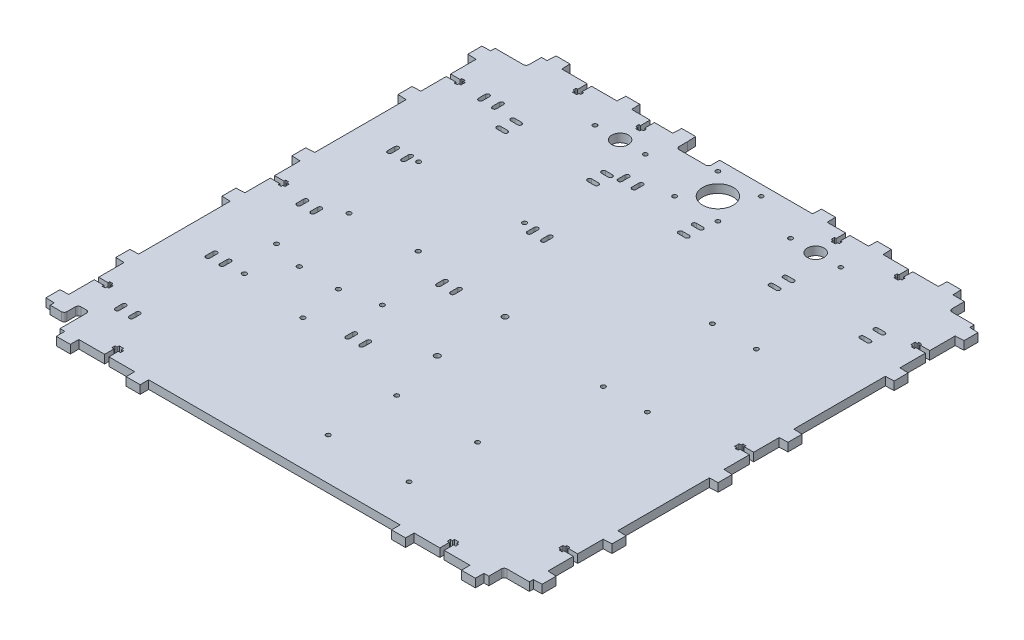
SolidWorks part; units mm, degrees
ref_plane "Спереди" through (0, 0, 0) normal (0, 0, 1) x (1, 0, 0)
ref_plane "Сверху" through (0, 0, 0) normal (0, 1, 0) x (1, 0, 0)
ref_plane "Справа" through (0, 0, 0) normal (1, 0, 0) x (0, 0, -1)
sketch "Эскиз1" plane through (0, 0, 0) normal (0, -1, 0) x (1, 0, 0)
  line L0 (171.5, 17.1) -> (171.5, 20.25)
  line L1 (171.5, 20.25) -> (177.6, 20.5)
  line L2 (177.6, 20.5) -> (177.6, 30.5)
  line L3 (177.6, 30.5) -> (171.5, 30.75)
  line L4 (171.5, 30.75) -> (171.5, 48.95)
  line L5 (171.5, 48.95) -> (164.7, 48.95)
  line L6 (164.7, 48.95) -> (164.7, 47.75)
  line L7 (164.7, 47.75) -> (162.5, 47.75)
  line L8 (162.5, 47.75) -> (162.5, 48.95)
  line L9 (162.5, 48.95) -> (161, 48.95)
  line L10 (161, 48.95) -> (161, 52.05)
  line L11 (161, 52.05) -> (162.5, 52.05)
  line L12 (162.5, 52.05) -> (162.5, 53.25)
  line L13 (162.5, 53.25) -> (164.7, 53.25)
  line L14 (164.7, 53.25) -> (164.7, 52.05)
  line L15 (164.7, 52.05) -> (171.5, 52.05)
  line L16 (171.5, 52.05) -> (171.5, 70.25)
  line L17 (171.5, 70.25) -> (177.6, 70.5)
  line L18 (177.6, 70.5) -> (177.6, 80.5)
  line L19 (177.6, 80.5) -> (171.5, 80.75)
  line L20 (177.6, 146.5) -> (177.6, 156.5)
  line L21 (177.6, 156.5) -> (171.5, 156.75)
  line L22 (171.5, 156.75) -> (171.5, 174.95)
  line L23 (171.5, 174.95) -> (164.7, 174.95)
  line L24 (164.7, 174.95) -> (164.7, 173.75)
  line L25 (164.7, 173.75) -> (162.5, 173.75)
  line L26 (162.5, 173.75) -> (162.5, 174.95)
  line L27 (162.5, 174.95) -> (161, 174.95)
  line L28 (161, 174.95) -> (161, 178.05)
  line L29 (161, 178.05) -> (162.5, 178.05)
  line L30 (162.5, 178.05) -> (162.5, 179.25)
  line L31 (162.5, 179.25) -> (164.7, 179.25)
  line L32 (164.7, 179.25) -> (164.7, 178.05)
  line L33 (164.7, 178.05) -> (171.5, 178.05)
  line L34 (171.5, 178.05) -> (171.5, 196.25)
  line L35 (171.5, 196.25) -> (177.6, 196.5)
  line L36 (177.6, 196.5) -> (177.6, 206.5)
  line L37 (177.6, 206.5) -> (171.5, 206.75)
  line L38 (171.5, 146.25) -> (177.6, 146.5)
  line L39 (177.6, 272.5) -> (177.6, 282.5)
  line L40 (177.6, 282.5) -> (171.5, 282.75)
  line L41 (171.5, 282.75) -> (171.5, 300.95)
  line L42 (171.5, 300.95) -> (164.7, 300.95)
  line L43 (164.7, 300.95) -> (164.7, 299.75)
  line L44 (164.7, 299.75) -> (162.5, 299.75)
  line L45 (162.5, 299.75) -> (162.5, 300.95)
  line L46 (162.5, 300.95) -> (161, 300.95)
  line L47 (161, 300.95) -> (161, 304.05)
  line L48 (161, 304.05) -> (162.5, 304.05)
  line L49 (162.5, 304.05) -> (162.5, 305.25)
  line L50 (162.5, 305.25) -> (164.7, 305.25)
  line L51 (164.7, 305.25) -> (164.7, 304.05)
  line L52 (164.7, 304.05) -> (171.5, 304.05)
  line L53 (171.5, 304.05) -> (171.5, 322.25)
  line L54 (171.5, 322.25) -> (177.6, 322.5)
  line L55 (177.6, 322.5) -> (177.6, 332.5)
  line L56 (177.6, 332.5) -> (171.5, 332.75)
  line L57 (171.5, 272.25) -> (177.6, 272.5)
  line L58 (171.5, 335.6) -> (171.5, 332.75)
  line L59 (171.5, 272.25) -> (171.5, 206.75)
  line L60 (171.5, 146.25) -> (171.5, 80.75)
  line L61 (153.5, 346.6) -> (150, 346.6)
  line L62 (150, 346.6) -> (150, 352.7)
  line L63 (150, 352.7) -> (140, 352.7)
  line L64 (140, 352.7) -> (140, 346.6)
  line L65 (140, 346.6) -> (121.55, 346.6)
  line L66 (121.55, 346.6) -> (121.55, 339.8)
  line L67 (121.55, 339.8) -> (123.05, 339.8)
  line L68 (123.05, 339.8) -> (123.05, 337.6)
  line L69 (123.05, 337.6) -> (121.55, 337.6)
  line L70 (121.55, 337.6) -> (121.55, 336.1)
  line L71 (121.55, 336.1) -> (118.45, 336.1)
  line L72 (118.45, 336.1) -> (118.45, 337.6)
  line L73 (118.45, 337.6) -> (116.95, 337.6)
  line L74 (116.95, 337.6) -> (116.95, 339.8)
  line L75 (116.95, 339.8) -> (118.45, 339.8)
  line L76 (118.45, 339.8) -> (118.45, 346.6)
  line L77 (118.45, 346.6) -> (100, 346.6)
  line L78 (100, 346.6) -> (100, 352.7)
  line L79 (100, 352.7) -> (90, 352.7)
  line L80 (90, 352.7) -> (90, 346.6)
  line L81 (90, 346.6) -> (-90, 346.6)
  line L82 (70, 16.6) -> (70, 0) construction
  line L83 (115, 16.6) -> (115, 0) construction
  line L84 (52, 29.1) -> (88, 29.1) construction
  line L85 (161, 50.5) -> (165.6426, 50.5) construction
  line L86 (-15.5, 13.6) -> (15.5, 13.6) construction
  line L87 (-15.5, 13.6) -> (-15.5, 44.6) construction
  line L88 (-15.5, 44.6) -> (15.5, 44.6) construction
  line L89 (15.5, 13.6) -> (15.5, 44.6) construction
  line L90 (-15.5, 13.6) -> (15.5, 44.6) construction
  line L91 (-15.5, 44.6) -> (15.5, 13.6) construction
  line L92 (-153.5, 335.6) -> (-171.5, 335.6)
  line L93 (-45, 0) -> (-55, 0)
  line L94 (-55, 0) -> (-55.25, 6.1)
  line L95 (-44.75, 6.1) -> (-45, 0)
  line L96 (-85, 0) -> (-95, 0)
  line L97 (-135, 0) -> (-145, 0)
  line L98 (-161, 50.5) -> (-165.6426, 50.5) construction
  line L99 (-52, 29.1) -> (-88, 29.1) construction
  line L100 (-115, 16.6) -> (-115, 0) construction
  line L101 (-70, 16.6) -> (-70, 0) construction
  line L102 (-171.5, 17.1) -> (-149.25, 17.1)
  line L103 (-145, 0) -> (-145.25, 6.1)
  line L104 (-134.75, 6.1) -> (-135, 0)
  line L105 (-116.55, 6.1) -> (-134.75, 6.1)
  line L106 (-116.55, 12.9) -> (-116.55, 6.1)
  line L107 (-117.75, 12.9) -> (-116.55, 12.9)
  line L108 (-117.75, 15.1) -> (-117.75, 12.9)
  line L109 (-116.55, 15.1) -> (-117.75, 15.1)
  line L110 (-116.55, 16.6) -> (-116.55, 15.1)
  line L111 (-113.45, 16.6) -> (-116.55, 16.6)
  line L112 (-113.45, 15.1) -> (-113.45, 16.6)
  line L113 (-112.25, 15.1) -> (-113.45, 15.1)
  line L114 (-112.25, 12.9) -> (-112.25, 15.1)
  line L115 (-113.45, 12.9) -> (-112.25, 12.9)
  line L116 (-113.45, 6.1) -> (-113.45, 12.9)
  line L117 (-95.25, 6.1) -> (-113.45, 6.1)
  line L118 (-95, 0) -> (-95.25, 6.1)
  line L119 (-84.75, 6.1) -> (-85, 0)
  line L120 (-71.55, 6.1) -> (-84.75, 6.1)
  line L121 (-71.55, 12.9) -> (-71.55, 6.1)
  line L122 (-72.75, 12.9) -> (-71.55, 12.9)
  line L123 (-72.75, 15.1) -> (-72.75, 12.9)
  line L124 (-71.55, 15.1) -> (-72.75, 15.1)
  line L125 (-71.55, 16.6) -> (-71.55, 15.1)
  line L126 (-68.45, 16.6) -> (-71.55, 16.6)
  line L127 (-68.45, 15.1) -> (-68.45, 16.6)
  line L128 (-67.25, 15.1) -> (-68.45, 15.1)
  line L129 (-67.25, 12.9) -> (-67.25, 15.1)
  line L130 (-68.45, 12.9) -> (-67.25, 12.9)
  line L131 (-68.45, 6.1) -> (-68.45, 12.9)
  line L132 (-55.25, 6.1) -> (-68.45, 6.1)
  line L133 (-177.6, 80.5) -> (-171.5, 80.75)
  line L134 (-177.6, 70.5) -> (-177.6, 80.5)
  line L135 (-171.5, 70.25) -> (-177.6, 70.5)
  line L136 (-171.5, 52.05) -> (-171.5, 70.25)
  line L137 (-164.7, 52.05) -> (-171.5, 52.05)
  line L138 (-164.7, 53.25) -> (-164.7, 52.05)
  line L139 (-162.5, 53.25) -> (-164.7, 53.25)
  line L140 (-162.5, 52.05) -> (-162.5, 53.25)
  line L141 (-161, 52.05) -> (-162.5, 52.05)
  line L142 (-161, 48.95) -> (-161, 52.05)
  line L143 (-162.5, 48.95) -> (-161, 48.95)
  line L144 (-162.5, 47.75) -> (-162.5, 48.95)
  line L145 (-164.7, 47.75) -> (-162.5, 47.75)
  line L146 (-164.7, 48.95) -> (-164.7, 47.75)
  line L147 (-171.5, 48.95) -> (-164.7, 48.95)
  line L148 (-171.5, 30.75) -> (-171.5, 48.95)
  line L149 (-177.6, 30.5) -> (-171.5, 30.75)
  line L150 (-177.6, 20.5) -> (-177.6, 30.5)
  line L151 (-171.5, 20.25) -> (-177.6, 20.5)
  line L152 (-171.5, 17.1) -> (-171.5, 20.25)
  line L153 (-153.5, 346.6) -> (-153.5, 335.6)
  line L154 (-90, 352.7) -> (-90, 346.6)
  line L155 (-100, 352.7) -> (-90, 352.7)
  line L156 (-100, 346.6) -> (-100, 352.7)
  line L157 (-118.45, 346.6) -> (-100, 346.6)
  line L158 (-118.45, 339.8) -> (-118.45, 346.6)
  line L159 (-116.95, 339.8) -> (-118.45, 339.8)
  line L160 (-116.95, 337.6) -> (-116.95, 339.8)
  line L161 (-118.45, 337.6) -> (-116.95, 337.6)
  line L162 (-118.45, 336.1) -> (-118.45, 337.6)
  line L163 (-121.55, 336.1) -> (-118.45, 336.1)
  line L164 (-121.55, 337.6) -> (-121.55, 336.1)
  line L165 (-123.05, 337.6) -> (-121.55, 337.6)
  line L166 (-123.05, 339.8) -> (-123.05, 337.6)
  line L167 (-121.55, 339.8) -> (-123.05, 339.8)
  line L168 (-121.55, 346.6) -> (-121.55, 339.8)
  line L169 (-140, 346.6) -> (-121.55, 346.6)
  line L170 (-140, 352.7) -> (-140, 346.6)
  line L171 (-150, 352.7) -> (-140, 352.7)
  line L172 (-150, 346.6) -> (-150, 352.7)
  line L173 (-153.5, 346.6) -> (-150, 346.6)
  line L174 (-171.5, 146.25) -> (-171.5, 80.75)
  line L175 (-171.5, 272.25) -> (-171.5, 206.75)
  line L176 (-171.5, 335.6) -> (-171.5, 332.75)
  line L177 (-171.5, 272.25) -> (-177.6, 272.5)
  line L178 (-177.6, 332.5) -> (-171.5, 332.75)
  line L179 (-177.6, 322.5) -> (-177.6, 332.5)
  line L180 (-171.5, 322.25) -> (-177.6, 322.5)
  line L181 (-171.5, 304.05) -> (-171.5, 322.25)
  line L182 (-164.7, 304.05) -> (-171.5, 304.05)
  line L183 (-164.7, 305.25) -> (-164.7, 304.05)
  line L184 (-162.5, 305.25) -> (-164.7, 305.25)
  line L185 (-162.5, 304.05) -> (-162.5, 305.25)
  line L186 (-161, 304.05) -> (-162.5, 304.05)
  line L187 (-161, 300.95) -> (-161, 304.05)
  line L188 (-162.5, 300.95) -> (-161, 300.95)
  line L189 (-162.5, 299.75) -> (-162.5, 300.95)
  line L190 (-164.7, 299.75) -> (-162.5, 299.75)
  line L191 (-164.7, 300.95) -> (-164.7, 299.75)
  line L192 (-171.5, 300.95) -> (-164.7, 300.95)
  line L193 (-171.5, 282.75) -> (-171.5, 300.95)
  line L194 (-177.6, 282.5) -> (-171.5, 282.75)
  line L195 (-177.6, 272.5) -> (-177.6, 282.5)
  line L196 (-171.5, 146.25) -> (-177.6, 146.5)
  line L197 (-177.6, 206.5) -> (-171.5, 206.75)
  line L198 (-177.6, 196.5) -> (-177.6, 206.5)
  line L199 (-171.5, 196.25) -> (-177.6, 196.5)
  line L200 (-171.5, 178.05) -> (-171.5, 196.25)
  line L201 (-164.7, 178.05) -> (-171.5, 178.05)
  line L202 (-164.7, 179.25) -> (-164.7, 178.05)
  line L203 (-44.75, 6.1) -> (44.75, 6.1)
  line L204 (44.75, 6.1) -> (45, 0)
  line L205 (45, 0) -> (55, 0)
  line L206 (55, 0) -> (55.25, 6.1)
  line L207 (55.25, 6.1) -> (68.45, 6.1)
  line L208 (68.45, 6.1) -> (68.45, 12.9)
  line L209 (68.45, 12.9) -> (67.25, 12.9)
  line L210 (67.25, 12.9) -> (67.25, 15.1)
  line L211 (67.25, 15.1) -> (68.45, 15.1)
  line L212 (68.45, 15.1) -> (68.45, 16.6)
  line L213 (68.45, 16.6) -> (71.55, 16.6)
  line L214 (71.55, 16.6) -> (71.55, 15.1)
  line L215 (71.55, 15.1) -> (72.75, 15.1)
  line L216 (72.75, 15.1) -> (72.75, 12.9)
  line L217 (72.75, 12.9) -> (71.55, 12.9)
  line L218 (71.55, 12.9) -> (71.55, 6.1)
  line L219 (71.55, 6.1) -> (84.75, 6.1)
  line L220 (84.75, 6.1) -> (85, 0)
  line L221 (85, 0) -> (95, 0)
  line L222 (95, 0) -> (95.25, 6.1)
  line L223 (95.25, 6.1) -> (113.45, 6.1)
  line L224 (113.45, 6.1) -> (113.45, 12.9)
  line L225 (113.45, 12.9) -> (112.25, 12.9)
  line L226 (112.25, 12.9) -> (112.25, 15.1)
  line L227 (112.25, 15.1) -> (113.45, 15.1)
  line L228 (113.45, 15.1) -> (113.45, 16.6)
  line L229 (113.45, 16.6) -> (116.55, 16.6)
  line L230 (116.55, 16.6) -> (116.55, 15.1)
  line L231 (116.55, 15.1) -> (117.75, 15.1)
  line L232 (117.75, 15.1) -> (117.75, 12.9)
  line L233 (117.75, 12.9) -> (116.55, 12.9)
  line L234 (116.55, 12.9) -> (116.55, 6.1)
  line L235 (116.55, 6.1) -> (134.75, 6.1)
  line L236 (134.75, 6.1) -> (135, 0)
  line L237 (135, 0) -> (145, 0)
  line L238 (145, 0) -> (145.25, 6.1)
  line L239 (145.25, 6.1) -> (153.5, 6.1)
  line L240 (0, 346.6) -> (0, 0) construction
  line L241 (0, 0) -> (321.4355, 0) construction
  line L242 (-162.5, 179.25) -> (-164.7, 179.25)
  line L243 (-162.5, 178.05) -> (-162.5, 179.25)
  line L244 (-161, 178.05) -> (-162.5, 178.05)
  line L245 (-161, 174.95) -> (-161, 178.05)
  line L246 (-162.5, 174.95) -> (-161, 174.95)
  line L247 (-162.5, 173.75) -> (-162.5, 174.95)
  line L248 (-164.7, 173.75) -> (-162.5, 173.75)
  line L249 (-164.7, 174.95) -> (-164.7, 173.75)
  line L250 (-171.5, 174.95) -> (-164.7, 174.95)
  line L251 (-171.5, 156.75) -> (-171.5, 174.95)
  line L252 (-177.6, 156.5) -> (-171.5, 156.75)
  line L253 (-177.6, 146.5) -> (-177.6, 156.5)
  line L254 (171.5, 17.1) -> (153.5, 17.1)
  line L255 (153.5, 17.1) -> (153.5, 6.1)
  line L256 (-149.25, 17.1) -> (-149.25, 6.1)
  line L257 (-149.25, 6.1) -> (-145.25, 6.1)
  line L258 (153.5, 346.6) -> (153.5, 335.6)
  line L259 (153.5, 335.6) -> (171.5, 335.6)
  line L260 (120, 336.1) -> (120, 359.0244) construction
  line L261 (161, 176.5) -> (-15.5, 176.5) construction
  circle A2 centre (-15.5, 44.6) radius 1.5
  circle A3 centre (-15.5, 13.6) radius 1.5
  circle A4 centre (-70, 29.1) radius 5.95
  circle A5 centre (-52, 29.1) radius 1.5
  circle A6 centre (-88, 29.1) radius 1.5
  circle A9 centre (0, 29.1) radius 11
  circle A10 centre (88, 29.1) radius 1.5
  circle A11 centre (52, 29.1) radius 1.5
  circle A12 centre (70, 29.1) radius 5.95
  circle A14 centre (15.5, 13.6) radius 1.5
  circle A15 centre (15.5, 44.6) radius 1.5
  point P23 (177.6, 25.5)
  point P24 (177.6, 75.5)
  point P45 (177.6, 327.5)
  point P64 (177.6, 201.5)
  point P93 (50, 0)
  point P94 (90, 0)
  point P95 (140, 0)
  point P103 (161, 176.5)
  point P110 (0, 6.1)
  point P181 (177.6, 201.5)
  dimension "D3" = 11.9
  dimension "D4" = 22
  dimension "D5" = 31
  dimension "D8" = 23
  dimension "D10" = 140
  dimension "D11" = 3
  dimension "D24" = 18
  dimension "D1" = 343
  dimension "D2" = 340.5
  dimension "D6" = 6.1
  dimension "D7" = 6.1
  dimension "D9" = 36
  dimension "D12" = 40
  dimension "D13" = 50
  dimension "D14" = 70
  dimension "D15" = 10
  dimension "D16" = 10.5
  dimension "D17" = 3.1
  dimension "D18" = 10.5
  dimension "D19" = 45
  dimension "D20" = 2.2
  dimension "D21" = 5.5
  dimension "D22" = 1.5
  dimension "D23" = 100
  dimension "D25" = 6.1
  dimension "D26" = 50
  dimension "D27" = 50
  dimension "D28" = 101
  dimension "D30" = 176.5
  dimension "D31" = 10
  dimension "D32" = 11
  dimension "D33" = 90
  dimension "D34" = 30
  dimension "D35" = 4
  dimension "D29" = 3
extrude "Бобышка-Вытянуть1" add sketch "Эскиз1" against normal blind 6
fillet "Скругление1" radius 2 4 edges at (153.5, 3, 17.1) (153.5, 3, 335.6) (-153.5, 3, 335.6) (-149.25, 3, 17.1)
sketch "Эскиз2" plane through (0, 0, 0) normal (0, -1, 0) x (1, 0, 0)
  line L0 (-106.26, 222.47) -> (-78.32, 222.47) construction
  line L1 (-73.24, 170.4) -> (-73.24, 252.95) construction
  line L2 (-121.5, 246.6) -> (-73.24, 246.6) construction
  line L3 (-121.5, 171.67) -> (-121.5, 246.6) construction
  line L4 (-171.5, 272.25) -> (-171.5, 206.75) construction
  line L5 (90, 346.6) -> (-90, 346.6) construction
  circle A0 centre (-73.24, 252.95) radius 1.6
  circle A1 centre (-121.5, 171.67) radius 1.6
  circle A2 centre (-121.5, 246.6) radius 1.6
  circle A3 centre (-73.24, 170.4) radius 1.6
  circle A4 centre (-106.26, 222.47) radius 1.6
  circle A5 centre (-78.32, 222.47) radius 1.6
  dimension "D10" = 3.2
  dimension "D2" = 6.35
  dimension "D5" = 5.08
  dimension "D3" = 48.26
  dimension "D4" = 82.55
  dimension "D6" = 74.93
  dimension "D7" = 24.13
  dimension "D8" = 27.94
  dimension "D9" = 50
  dimension "D11" = 100
sketch "Эскиз4" plane through (0, 6, 0) normal (0, -1, 0) x (1, 0, 0)
  line L0 (-44.75, 6.1) -> (44.75, 6.1) construction
  line L1 (-44.75, 6.1) -> (-21.75, 6.1)
  line L2 (-44.75, 6.1) -> (-44.75, 14.1)
  line L3 (-44.75, 14.1) -> (-21.75, 14.1)
  line L4 (-21.75, 6.1) -> (-21.75, 14.1)
  dimension "D1" = 23
  dimension "D2" = 8
extrude "Вырез-Вытянуть2" cut sketch "Эскиз4" along normal through all
fillet "Скругление2" radius 2 2 edges at (-44.75, 3, 14.1) (-21.75, 3, 14.1)
extrude "Вырез-Вытянуть3" cut sketch "Эскиз2" against normal through all
sketch "Эскиз3" plane through (0, 0, 0) normal (0, -1, 0) x (1, 0, 0)
  line L0 (-1.5, 228.5) -> (-1.5, 180) construction
  line L1 (-171.5, 272.25) -> (-171.5, 206.75) construction
  circle A0 centre (-1.5, 228.5) radius 2.05
  circle A1 centre (-1.5, 180) radius 2.05
  dimension "D1" = 48.5
  dimension "D2" = 4.1
  dimension "D3" = 170
  dimension "D4" = 180
extrude "Вырез-Вытянуть1" cut sketch "Эскиз3" against normal through all
sketch "Эскиз8" plane through (0, 0, 0) normal (0, -1, 0) x (1, 0, 0)
  line L0 (0, 0) -> (0, 358.0483) construction
  line L1 (0, 0) -> (-168.3703, 0) construction
  line L2 (-140, 267.0244) -> (-140, 0) construction
  line L3 (-145, 0) -> (-135, 0) construction
  line L4 (-40, 254.7845) -> (-40, 0) construction
  line L5 (-145, 249.1) -> (-145, 244.1) construction
  line L6 (-143.5, 249.1) -> (-143.5, 244.1)
  line L7 (-146.5, 249.1) -> (-146.5, 244.1)
  line L8 (-45, 249.1) -> (-45, 244.1) construction
  line L9 (-43.5, 249.1) -> (-43.5, 244.1)
  line L10 (-46.5, 249.1) -> (-46.5, 244.1)
  line L11 (-45, 184.1) -> (-45, 179.1) construction
  line L12 (-43.5, 184.1) -> (-43.5, 179.1)
  line L13 (-46.5, 184.1) -> (-46.5, 179.1)
  line L14 (-45, 119.1) -> (-45, 114.1) construction
  line L15 (-43.5, 119.1) -> (-43.5, 114.1)
  line L16 (-46.5, 119.1) -> (-46.5, 114.1)
  line L17 (-45, 54.1) -> (-45, 49.1) construction
  line L18 (-43.5, 54.1) -> (-43.5, 49.1)
  line L19 (-46.5, 54.1) -> (-46.5, 49.1)
  line L20 (-145, 314.1) -> (-145, 309.1) construction
  line L21 (-143.5, 314.1) -> (-143.5, 309.1)
  line L22 (-146.5, 314.1) -> (-146.5, 309.1)
  line L23 (-145, 184.1) -> (-145, 179.1) construction
  line L24 (-143.5, 184.1) -> (-143.5, 179.1)
  line L25 (-146.5, 184.1) -> (-146.5, 179.1)
  line L26 (-145, 119.1) -> (-145, 114.1) construction
  line L27 (-143.5, 119.1) -> (-143.5, 114.1)
  line L28 (-146.5, 119.1) -> (-146.5, 114.1)
  line L29 (-145, 54.1) -> (-145, 49.1) construction
  line L30 (-143.5, 54.1) -> (-143.5, 49.1)
  line L31 (-146.5, 54.1) -> (-146.5, 49.1)
  line L32 (-135, 314.1) -> (-135, 309.1) construction
  line L33 (-136.5, 314.1) -> (-136.5, 309.1)
  line L34 (-133.5, 314.1) -> (-133.5, 309.1)
  line L35 (-121.55, 346.6) -> (-140, 346.6) construction
  line L39 (-135, 54.1) -> (-135, 49.1) construction
  line L40 (-136.5, 54.1) -> (-136.5, 49.1)
  line L41 (-133.5, 54.1) -> (-133.5, 49.1)
  line L42 (-135, 119.1) -> (-135, 114.1) construction
  line L43 (-136.5, 119.1) -> (-136.5, 114.1)
  line L44 (-133.5, 119.1) -> (-133.5, 114.1)
  line L45 (-135, 184.1) -> (-135, 179.1) construction
  line L46 (-136.5, 184.1) -> (-136.5, 179.1)
  line L47 (-133.5, 184.1) -> (-133.5, 179.1)
  line L48 (-135, 249.1) -> (-135, 244.1) construction
  line L49 (-136.5, 249.1) -> (-136.5, 244.1)
  line L50 (-133.5, 249.1) -> (-133.5, 244.1)
  line L81 (-45, 249.1) -> (-45, 184.1) construction
  line L82 (-35, 249.1) -> (-35, 184.1) construction
  line L86 (-35, 54.1) -> (-35, 49.1) construction
  line L87 (-36.5, 54.1) -> (-36.5, 49.1)
  line L88 (-33.5, 54.1) -> (-33.5, 49.1)
  line L89 (-35, 119.1) -> (-35, 114.1) construction
  line L90 (-36.5, 119.1) -> (-36.5, 114.1)
  line L91 (-33.5, 119.1) -> (-33.5, 114.1)
  line L92 (-35, 184.1) -> (-35, 179.1) construction
  line L93 (-36.5, 184.1) -> (-36.5, 179.1)
  line L94 (-33.5, 184.1) -> (-33.5, 179.1)
  line L95 (-35, 249.1) -> (-35, 244.1) construction
  line L96 (-36.5, 249.1) -> (-36.5, 244.1)
  line L97 (-33.5, 249.1) -> (-33.5, 244.1)
  line L458 (-135, 184.1) -> (-135, 179.1) construction
  line L459 (-133.5, 184.1) -> (-133.5, 179.1)
  line L460 (-136.5, 184.1) -> (-136.5, 179.1)
  line L461 (-135, 119.1) -> (-135, 114.1) construction
  line L462 (-133.5, 119.1) -> (-133.5, 114.1)
  line L463 (-136.5, 119.1) -> (-136.5, 114.1)
  line L464 (-135, 54.1) -> (-135, 49.1) construction
  line L465 (-133.5, 54.1) -> (-133.5, 49.1)
  line L466 (-136.5, 54.1) -> (-136.5, 49.1)
  line L467 (-135, 249.1) -> (-135, 244.1) construction
  line L468 (-133.5, 249.1) -> (-133.5, 244.1)
  line L469 (-136.5, 249.1) -> (-136.5, 244.1)
  line L470 (-135, 184.1) -> (-135, 179.1) construction
  line L471 (-133.5, 184.1) -> (-133.5, 179.1)
  line L472 (-136.5, 184.1) -> (-136.5, 179.1)
  line L473 (-135, 119.1) -> (-135, 114.1) construction
  line L474 (-133.5, 119.1) -> (-133.5, 114.1)
  line L475 (-136.5, 119.1) -> (-136.5, 114.1)
  line L476 (-135, 54.1) -> (-135, 49.1) construction
  line L477 (-133.5, 54.1) -> (-133.5, 49.1)
  line L478 (-136.5, 54.1) -> (-136.5, 49.1)
  line L479 (-135, 249.1) -> (-135, 244.1) construction
  line L480 (-133.5, 249.1) -> (-133.5, 244.1)
  line L481 (-136.5, 249.1) -> (-136.5, 244.1)
  arc A0 (-143.5, 249.1) -> (-146.5, 249.1) centre (-145, 249.1) ccw
  arc A1 (-146.5, 244.1) -> (-143.5, 244.1) centre (-145, 244.1) ccw
  arc A2 (-43.5, 249.1) -> (-46.5, 249.1) centre (-45, 249.1) ccw
  arc A3 (-46.5, 244.1) -> (-43.5, 244.1) centre (-45, 244.1) ccw
  arc A4 (-43.5, 184.1) -> (-46.5, 184.1) centre (-45, 184.1) ccw
  arc A5 (-46.5, 179.1) -> (-43.5, 179.1) centre (-45, 179.1) ccw
  arc A6 (-43.5, 119.1) -> (-46.5, 119.1) centre (-45, 119.1) ccw
  arc A7 (-46.5, 114.1) -> (-43.5, 114.1) centre (-45, 114.1) ccw
  arc A8 (-43.5, 54.1) -> (-46.5, 54.1) centre (-45, 54.1) ccw
  arc A9 (-46.5, 49.1) -> (-43.5, 49.1) centre (-45, 49.1) ccw
  arc A10 (-143.5, 314.1) -> (-146.5, 314.1) centre (-145, 314.1) ccw
  arc A11 (-146.5, 309.1) -> (-143.5, 309.1) centre (-145, 309.1) ccw
  arc A12 (-143.5, 184.1) -> (-146.5, 184.1) centre (-145, 184.1) ccw
  arc A13 (-146.5, 179.1) -> (-143.5, 179.1) centre (-145, 179.1) ccw
  arc A14 (-143.5, 119.1) -> (-146.5, 119.1) centre (-145, 119.1) ccw
  arc A15 (-146.5, 114.1) -> (-143.5, 114.1) centre (-145, 114.1) ccw
  arc A16 (-143.5, 54.1) -> (-146.5, 54.1) centre (-145, 54.1) ccw
  arc A17 (-146.5, 49.1) -> (-143.5, 49.1) centre (-145, 49.1) ccw
  arc A18 (-136.5, 314.1) -> (-133.5, 314.1) centre (-135, 314.1) cw
  arc A19 (-133.5, 309.1) -> (-136.5, 309.1) centre (-135, 309.1) cw
  arc A22 (-136.5, 54.1) -> (-133.5, 54.1) centre (-135, 54.1) cw
  arc A23 (-133.5, 49.1) -> (-136.5, 49.1) centre (-135, 49.1) cw
  arc A24 (-136.5, 119.1) -> (-133.5, 119.1) centre (-135, 119.1) cw
  arc A25 (-133.5, 114.1) -> (-136.5, 114.1) centre (-135, 114.1) cw
  arc A26 (-136.5, 184.1) -> (-133.5, 184.1) centre (-135, 184.1) cw
  arc A27 (-133.5, 179.1) -> (-136.5, 179.1) centre (-135, 179.1) cw
  arc A28 (-136.5, 249.1) -> (-133.5, 249.1) centre (-135, 249.1) cw
  arc A29 (-133.5, 244.1) -> (-136.5, 244.1) centre (-135, 244.1) cw
  arc A32 (-36.5, 54.1) -> (-33.5, 54.1) centre (-35, 54.1) cw
  arc A33 (-33.5, 49.1) -> (-36.5, 49.1) centre (-35, 49.1) cw
  arc A34 (-36.5, 119.1) -> (-33.5, 119.1) centre (-35, 119.1) cw
  arc A35 (-33.5, 114.1) -> (-36.5, 114.1) centre (-35, 114.1) cw
  arc A36 (-36.5, 184.1) -> (-33.5, 184.1) centre (-35, 184.1) cw
  arc A37 (-33.5, 179.1) -> (-36.5, 179.1) centre (-35, 179.1) cw
  arc A38 (-36.5, 249.1) -> (-33.5, 249.1) centre (-35, 249.1) cw
  arc A39 (-33.5, 244.1) -> (-36.5, 244.1) centre (-35, 244.1) cw
  arc A298 (-133.5, 184.1) -> (-136.5, 184.1) centre (-135, 184.1) ccw
  arc A299 (-136.5, 179.1) -> (-133.5, 179.1) centre (-135, 179.1) ccw
  arc A300 (-133.5, 119.1) -> (-136.5, 119.1) centre (-135, 119.1) ccw
  arc A301 (-136.5, 114.1) -> (-133.5, 114.1) centre (-135, 114.1) ccw
  arc A302 (-133.5, 54.1) -> (-136.5, 54.1) centre (-135, 54.1) ccw
  arc A303 (-136.5, 49.1) -> (-133.5, 49.1) centre (-135, 49.1) ccw
  arc A304 (-133.5, 249.1) -> (-136.5, 249.1) centre (-135, 249.1) ccw
  arc A305 (-136.5, 244.1) -> (-133.5, 244.1) centre (-135, 244.1) ccw
  point P12 (-145, 246.6)
  point P21 (-45, 246.6)
  point P22 (-136, 193.6)
  point P29 (-136, 143.6)
  point P31 (-45, 181.6)
  point P36 (-136, 93.6)
  point P39 (-45, 116.6)
  point P43 (-136, 43.6)
  point P47 (-45, 51.6)
  point P51 (-145, 311.6)
  point P57 (-145, 181.6)
  point P64 (-145, 116.6)
  point P71 (-145, 51.6)
  point P79 (-135, 311.6)
  point P85 (-136, 243.6)
  point P93 (-135, 51.6)
  point P100 (-135, 116.6)
  point P107 (-135, 181.6)
  point P114 (-135, 246.6)
  point P121 (-136, 193.6)
  point P128 (-136, 143.6)
  point P135 (-136, 93.6)
  point P142 (-136, 43.6)
  point P149 (-136, 243.6)
  point P156 (-135, 193.6)
  point P163 (-135, 143.6)
  point P170 (-135, 93.6)
  point P177 (-135, 43.6)
  point P184 (-135, 243.6)
  point P205 (-35, 51.6)
  point P212 (-35, 116.6)
  point P218 (-35, 181.6)
  point P224 (-35, 246.6)
  point P231 (-135, 193.6)
  point P238 (-135, 143.6)
  point P245 (-135, 93.6)
  point P252 (-135, 43.6)
  point P259 (-135, 243.6)
  point P266 (-135, 193.6)
  point P273 (-135, 143.6)
  point P280 (-135, 93.6)
  point P287 (-135, 43.6)
  point P294 (-135, 243.6)
  point P301 (-135, 193.6)
  point P308 (-135, 143.6)
  point P315 (-135, 93.6)
  point P322 (-135, 43.6)
  point P329 (-135, 243.6)
  point P336 (-135, 193.6)
  point P343 (-135, 143.6)
  point P350 (-135, 93.6)
  point P357 (-135, 43.6)
  point P364 (-135, 243.6)
  point P371 (-135, 193.6)
  point P378 (-135, 143.6)
  point P385 (-135, 93.6)
  point P392 (-135, 43.6)
  point P399 (-135, 243.6)
  point P406 (-135, 193.6)
  point P413 (-135, 143.6)
  point P420 (-135, 93.6)
  point P427 (-135, 43.6)
  point P434 (-135, 243.6)
  point P441 (-135, 193.6)
  point P448 (-135, 143.6)
  point P455 (-135, 93.6)
  point P462 (-135, 43.6)
  point P469 (-135, 243.6)
  point P476 (-135, 178.6)
  point P483 (-135, 113.6)
  point P490 (-135, 48.6)
  point P504 (-135, 243.6)
  point P511 (-135, 178.6)
  point P518 (-135, 113.6)
  point P525 (-135, 48.6)
  point P532 (-135, 243.6)
  point P539 (-135, 178.6)
  point P546 (-135, 113.6)
  point P553 (-135, 48.6)
  point P560 (-135, 243.6)
  point P567 (-135, 178.6)
  point P574 (-135, 113.6)
  point P581 (-135, 48.6)
  point P588 (-135, 243.6)
  point P595 (-135, 178.6)
  point P602 (-135, 113.6)
  point P609 (-135, 48.6)
  point P616 (-135, 243.6)
  point P623 (-135, 178.6)
  point P630 (-135, 113.6)
  point P637 (-135, 48.6)
  point P644 (-135, 243.6)
  point P651 (-135, 178.6)
  point P658 (-135, 113.6)
  point P665 (-135, 48.6)
  point P672 (-135, 243.6)
  point P679 (-135, 178.6)
  point P686 (-135, 113.6)
  point P693 (-135, 48.6)
  point P700 (-135, 243.6)
  point P707 (-135, 178.6)
  point P714 (-135, 113.6)
  point P721 (-135, 48.6)
  point P728 (-135, 243.6)
  point P735 (-135, 178.6)
  point P742 (-135, 113.6)
  point P749 (-135, 48.6)
  point P756 (-135, 243.6)
  point P763 (-135, 178.6)
  point P770 (-135, 113.6)
  point P777 (-135, 48.6)
  point P784 (-135, 243.6)
  point P791 (-135, 178.6)
  point P798 (-135, 113.6)
  point P805 (-135, 48.6)
  point P812 (-135, 243.6)
  point P819 (-135, 181.6)
  point P826 (-135, 116.6)
  point P833 (-135, 51.6)
  point P840 (-135, 246.6)
  point P847 (-135, 181.6)
  point P854 (-135, 116.6)
  point P861 (-135, 51.6)
  point P868 (-135, 246.6)
  point P875 (-135, 181.6)
  point P882 (-135, 116.6)
  point P889 (-135, 51.6)
  point P896 (-135, 246.6)
  point P903 (-135, 181.6)
  point P910 (-135, 116.6)
  point P917 (-135, 51.6)
  point P924 (-135, 246.6)
  point P931 (-135, 181.6)
  point P938 (-135, 116.6)
  point P945 (-135, 51.6)
  point P952 (-135, 246.6)
  point P959 (-135, 181.6)
  point P966 (-135, 116.6)
  point P973 (-135, 51.6)
  point P980 (-135, 246.6)
  point P987 (-135, 181.6)
  point P994 (-135, 116.6)
  point P1001 (-135, 51.6)
  point P1008 (-135, 246.6)
  point P1015 (-135, 181.6)
  point P1022 (-135, 116.6)
  point P1029 (-135, 51.6)
  point P1036 (-135, 246.6)
  point P1043 (-135, 181.6)
  point P1050 (-135, 116.6)
  point P1057 (-135, 51.6)
  point P1064 (-135, 246.6)
  point P1071 (-135, 181.6)
  point P1078 (-135, 116.6)
  point P1085 (-135, 51.6)
  point P1092 (-135, 246.6)
  point P1099 (-135, 181.6)
  point P1106 (-135, 116.6)
  point P1113 (-135, 51.6)
  point P1120 (-135, 246.6)
  dimension "D2" = 1.5
  dimension "D1" = 40
  dimension "D5" = 100
  dimension "D6" = 5
  dimension "D7" = 10
  dimension "D8" = 65
  dimension "D9" = 10
  dimension "D11" = 65
  dimension "D12" = 65
  dimension "D13" = 10
  dimension "D3" = 2
  dimension "D4" = 4
  dimension "D10" = 4
extrude "Вырез-Вытянуть4" cut sketch "Эскиз8" against normal through all and the other way through all
sketch "Эскиз9" plane through (0, 0, 0) normal (0, -1, 0) x (1, 0, 0)
  line L0 (-171.5, 60) -> (171.5, 60) construction
  line L1 (-171.5, 70.25) -> (-171.5, 52.05) construction
  line L2 (171.5, 52.05) -> (171.5, 70.25) construction
  line L3 (144, 65) -> (139, 65) construction
  line L4 (144, 63.5) -> (139, 63.5)
  line L5 (144, 66.5) -> (139, 66.5)
  line L6 (79, 65) -> (74, 65) construction
  line L7 (79, 63.5) -> (74, 63.5)
  line L8 (79, 66.5) -> (74, 66.5)
  line L9 (14, 65) -> (9, 65) construction
  line L10 (14, 63.5) -> (9, 63.5)
  line L11 (14, 66.5) -> (9, 66.5)
  line L12 (-51, 65) -> (-56, 65) construction
  line L13 (-51, 63.5) -> (-56, 63.5)
  line L14 (-51, 66.5) -> (-56, 66.5)
  line L15 (-116, 65) -> (-121, 65) construction
  line L16 (-116, 63.5) -> (-121, 63.5)
  line L17 (-116, 66.5) -> (-121, 66.5)
  line L21 (144, 65) -> (79, 65) construction
  line L22 (144, 55) -> (79, 55) construction
  line L26 (-116, 55) -> (-121, 55) construction
  line L27 (-116, 56.5) -> (-121, 56.5)
  line L28 (-116, 53.5) -> (-121, 53.5)
  line L29 (-51, 55) -> (-56, 55) construction
  line L30 (-51, 56.5) -> (-56, 56.5)
  line L31 (-51, 53.5) -> (-56, 53.5)
  line L32 (14, 55) -> (9, 55) construction
  line L33 (14, 56.5) -> (9, 56.5)
  line L34 (14, 53.5) -> (9, 53.5)
  line L35 (79, 55) -> (74, 55) construction
  line L36 (79, 56.5) -> (74, 56.5)
  line L37 (79, 53.5) -> (74, 53.5)
  line L38 (144, 55) -> (139, 55) construction
  line L39 (144, 56.5) -> (139, 56.5)
  line L40 (144, 53.5) -> (139, 53.5)
  arc A0 (144, 63.5) -> (144, 66.5) centre (144, 65) ccw
  arc A1 (139, 66.5) -> (139, 63.5) centre (139, 65) ccw
  arc A2 (79, 63.5) -> (79, 66.5) centre (79, 65) ccw
  arc A3 (74, 66.5) -> (74, 63.5) centre (74, 65) ccw
  arc A4 (14, 63.5) -> (14, 66.5) centre (14, 65) ccw
  arc A5 (9, 66.5) -> (9, 63.5) centre (9, 65) ccw
  arc A6 (-51, 63.5) -> (-51, 66.5) centre (-51, 65) ccw
  arc A7 (-56, 66.5) -> (-56, 63.5) centre (-56, 65) ccw
  arc A8 (-116, 63.5) -> (-116, 66.5) centre (-116, 65) ccw
  arc A9 (-121, 66.5) -> (-121, 63.5) centre (-121, 65) ccw
  arc A14 (-116, 56.5) -> (-116, 53.5) centre (-116, 55) cw
  arc A15 (-121, 53.5) -> (-121, 56.5) centre (-121, 55) cw
  arc A16 (-51, 56.5) -> (-51, 53.5) centre (-51, 55) cw
  arc A17 (-56, 53.5) -> (-56, 56.5) centre (-56, 55) cw
  arc A18 (14, 56.5) -> (14, 53.5) centre (14, 55) cw
  arc A19 (9, 53.5) -> (9, 56.5) centre (9, 55) cw
  arc A20 (79, 56.5) -> (79, 53.5) centre (79, 55) cw
  arc A21 (74, 53.5) -> (74, 56.5) centre (74, 55) cw
  arc A22 (144, 56.5) -> (144, 53.5) centre (144, 55) cw
  arc A23 (139, 53.5) -> (139, 56.5) centre (139, 55) cw
  point P8 (141.5, 65)
  point P17 (76.5, 65)
  point P24 (11.5, 65)
  point P31 (-53.5, 65)
  point P39 (-118.5, 65)
  point P62 (-118.5, 55)
  point P69 (-53.5, 55)
  point P76 (11.5, 55)
  point P82 (76.5, 55)
  point P88 (141.5, 55)
  dimension "D3" = 1.5
  dimension "D1" = 10
  dimension "D2" = 5
  dimension "D4" = 60
  dimension "D5" = 30
  dimension "D6" = 65
  dimension "D7" = 5
extrude "Вырез-Вытянуть5" cut sketch "Эскиз9" against normal through all
sketch "Эскиз10" plane through (0, 0, 0) normal (0, -1, 0) x (1, 0, 0)
  line L0 (-155.5, 335.6) -> (-171.5, 335.6) construction
  line L1 (-153.5, 337.6) -> (-161.5, 337.6)
  line L2 (-153.5, 337.6) -> (-153.5, 325.6)
  line L3 (-153.5, 325.6) -> (-161.5, 325.6)
  line L4 (-161.5, 337.6) -> (-161.5, 325.6)
  dimension "D1" = 10
  dimension "D2" = 8
extrude "Вырез-Вытянуть6" cut sketch "Эскиз10" against normal through all
fillet "Скругление3" radius 2 3 edges at (-161.5, 3, 325.6) (-153.5, 3, 325.6) (-161.5, 3, 335.6)
sketch "Эскиз11" plane through (0, 0, 0) normal (0, -1, 0) x (1, 0, 0)
  line L0 (95.25, 6.1) -> (113.45, 6.1) construction
  line L1 (77, 188.1) -> (108.5, 188.1) construction
  line L2 (77, 188.1) -> (77, 110.1) construction
  line L3 (77, 110.1) -> (108.5, 110.1) construction
  line L4 (108.5, 188.1) -> (108.5, 110.1) construction
  line L5 (43.5, 245.1) -> (141.5, 245.1) construction
  line L6 (43.5, 245.1) -> (43.5, 86.1) construction
  line L7 (43.5, 86.1) -> (141.5, 86.1) construction
  line L8 (141.5, 245.1) -> (141.5, 86.1) construction
  line L9 (171.5, 206.75) -> (171.5, 272.25) construction
  circle A0 centre (77, 188.1) radius 1.55
  circle A1 centre (108.5, 188.1) radius 1.55
  circle A2 centre (108.5, 110.1) radius 1.55
  circle A3 centre (77, 110.1) radius 1.55
  dimension "D1" = 3.1
  dimension "D2" = 31.5
  dimension "D3" = 78
  dimension "D4" = 57
  dimension "D5" = 33
  dimension "D6" = 98
  dimension "D7" = 159
  dimension "D8" = 80
  dimension "D9" = 30
extrude "Вырез-Вытянуть7" cut sketch "Эскиз11" against normal through all
sketch "Эскиз12" plane through (0, 0, 0) normal (0, -1, 0) x (1, 0, 0)
  line L0 (90, 346.6) -> (-90, 346.6) construction
  line L1 (-128.5, 216.6) -> (-52.7, 216.6) construction
  line L2 (-128.5, 216.6) -> (-128.5, 114.8) construction
  line L3 (-128.5, 114.8) -> (-52.7, 114.8) construction
  line L4 (-52.7, 216.6) -> (-52.7, 114.8) construction
  line L6 (-171.5, 272.25) -> (-171.5, 206.75) construction
  circle A0 centre (-128.5, 216.6) radius 1.55
  circle A1 centre (-52.7, 216.6) radius 1.55
  circle A2 centre (-52.7, 114.8) radius 1.55
  circle A3 centre (-128.5, 114.8) radius 1.55
  dimension "D1" = 3.1
  dimension "D2" = 75.8
  dimension "D3" = 101.8
  dimension "D4" = 130
  dimension "D5" = 43
extrude "MKS BASE V1.5/MKS BASE-L V2.1 " cut sketch "Эскиз12" against normal through all
sketch "Эскиз13" plane through (0, 0, 0) normal (0, -1, 0) x (1, 0, 0)
  line L0 (90, 346.6) -> (-90, 346.6) construction
  line L1 (8.5, 316.6) -> (66.5, 316.6) construction
  line L2 (8.5, 316.6) -> (8.5, 267.6) construction
  line L3 (8.5, 267.6) -> (66.5, 267.6) construction
  line L4 (66.5, 316.6) -> (66.5, 267.6) construction
  line L5 (-171.5, 300.95) -> (-171.5, 282.75) construction
  circle A0 centre (8.5, 316.6) radius 1.55
  circle A1 centre (8.5, 267.6) radius 1.55
  circle A2 centre (66.5, 316.6) radius 1.55
  circle A3 centre (66.5, 267.6) radius 1.55
  dimension "D1" = 3.1
  dimension "D2" = 58
  dimension "D3" = 49
  dimension "D4" = 30
  dimension "D5" = 180
extrude "Вырез-Вытянуть8" cut sketch "Эскиз13" against normal through all
